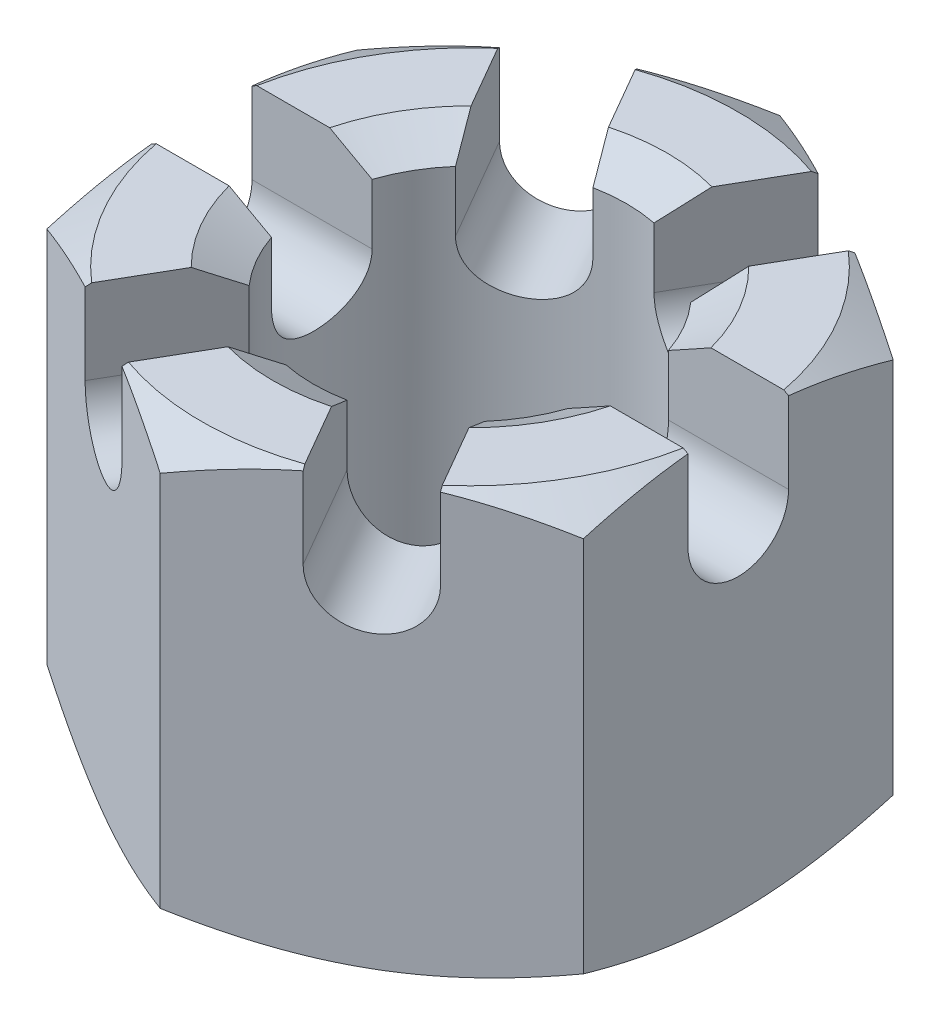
SolidWorks part; units mm, degrees
ref_plane "Front Plane" through (0, 0, 0) normal (0, 0, 1) x (1, 0, 0)
ref_plane "Top Plane" through (0, 0, 0) normal (0, 1, 0) x (1, 0, 0)
ref_plane "Right Plane" through (0, 0, 0) normal (1, 0, 0) x (0, 0, -1)
sketch "BaseNutSke" plane through (0, 0, 0) normal (0, 1, 0) x (1, 0, 0)
  line L1 (0, 13.8564) -> (-12, 6.9282)
  line L2 (-12, 6.9282) -> (-12, -6.9282)
  line L3 (-12, -6.9282) -> (0, -13.8564)
  line L4 (0, -13.8564) -> (12, -6.9282)
  line L5 (12, -6.9282) -> (12, 6.9282)
  line L6 (12, 6.9282) -> (0, 13.8564)
  circle A0 centre (0, 0) radius 12 construction
  dimension "Width" = 24
extrude "BaseNut" add sketch "BaseNutSke" along normal blind 19
ref_plane "MidPlane" through (0, 9.5, 0) normal (0, 1, 0) x (-1, 0, 0)
sketch "CutNutSke" plane through (0, 0, 0) normal (1, 0, 0) x (0, 0, -1)
  line L0 (-13.8564, 19) -> (-12, 19)
  line L1 (-12, 19) -> (-13.8564, 17.9282)
  line L2 (-13.8564, 17.9282) -> (-13.8564, 19)
  line L3 (0, 0) -> (0, 8.4136) construction
  dimension "Chamf_ang" = 30
  dimension "Chamfer_diameter" = 24
revolve "CutNut" cut sketch "CutNutSke" angle 360 about L3
mirror "MirrorChamfer" about plane through (0, 9.5, 0) normal (0, 1, 0) of "CutNut"
sketch "HoleSke" plane through (0, 19, 0) normal (0, 1, 0) x (1, 0, 0)
  circle A0 centre (0, 0) radius 7
  dimension "Tap_drill" = 14
extrude "TappedHole" cut sketch "HoleSke" against normal through all
chamfer "Chamfer1" distance 1.05 angle 60 2 edges at (0, 19, 7) (0, 0, 7)
sketch "SlotSke" plane through (0, 0, 0) normal (1, 0, 0) x (0, 0, -1)
  line L0 (0, 0) -> (0, 7.747) construction
  line L2 (-2.25, 32) -> (2.25, 32)
  line L3 (-2.25, 32) -> (-2.25, 15.25)
  line L4 (-2.25, 13) -> (2.25, 13) construction
  line L5 (2.25, 32) -> (2.25, 15.25)
  arc A0 (2.25, 15.25) -> (-2.25, 15.25) centre (0, 15.25) cw
  dimension "D1" = 19
  dimension "Slot_height" = 13
  dimension "Slot_width" = 4.5
extrude "Slot" cut sketch "SlotSke" against normal blind 28.8
pattern_circular "SlotPat" count 6 over 360 about axis through (0, 0, 0) along (0, 1, 0) of "Slot"
sketch "ThdSchSke" plane through (0, 0, 0) normal (0, 0, 1) x (1, 0, 0)
  line L0 (-8, 1.6274) -> (-7, 1.05)
  line L1 (-7, 1.05) -> (-5.8453, 1.05)
  line L2 (-5.8453, 1.05) -> (-5.8453, 2.2047)
  line L3 (-5.8453, 2.2047) -> (-7, 2.2047)
  line L4 (-7, 2.2047) -> (-8, 1.6274)
  line L5 (0, -3.4988) -> (0, 3.4988) construction
  line L8 (7, 1.05) -> (-7, 1.05) construction
  line L9 (7, 1.05) -> (-7, 1.05) construction
  dimension "ThreadN" = 16
  dimension "Tap_drill" = 14
revolve "ThreadSchematic" [suppressed] cut sketch "ThdSchSke" angle 360 about L5
pattern_linear "ThdSchPat" [suppressed]
equation "\"Chamfer_diameter@CutNutSke\" = \"Width@BaseNutSke\""
equation "\"D1@Chamfer1\" = \"Tap_drill@HoleSke\"*0.075"
equation "\"D1@SlotSke\" = \"Height@BaseNut\""
equation "\"D1@Slot\" = \"Width@BaseNutSke\"*1.2"
equation "\"Tap_drill@ThdSchSke\" = \"Tap_drill@HoleSke\""
equation "\"ThreadN@ThdSchSke\" = \"Thread_major@ThreadCosmetic\""
equation "\"Num_threads@ThdSchPat\" =  int(( \"Height@BaseNut\" - \"D1@Chamfer1\" *2) /\"Advance@ThdSchPat\" )  + 1"
